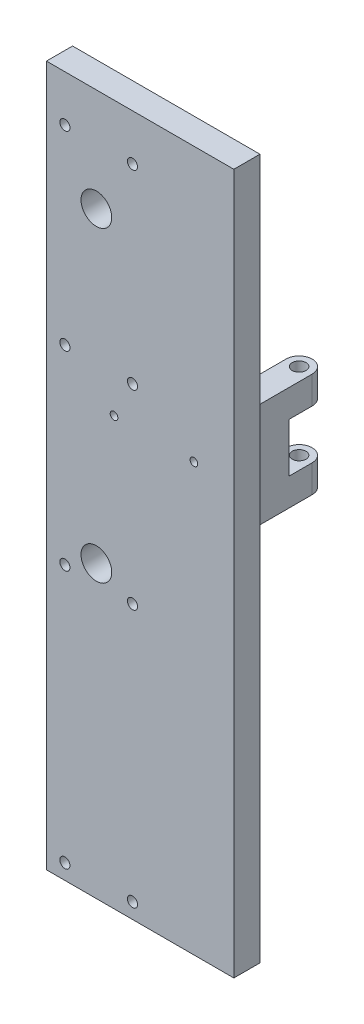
SolidWorks part; units mm, degrees
ref_plane "Face" through (0, 0, 0) normal (0, 0, 1) x (1, 0, 0)
ref_plane "Dessus" through (0, 0, 0) normal (0, 1, 0) x (1, 0, 0)
ref_plane "Droite" through (0, 0, 0) normal (1, 0, 0) x (0, 0, -1)
sketch "Esquisse1" plane through (0, 0, 0) normal (0, 0, 1) x (1, 0, 0)
  line L1 (0, 0) -> (122, 0)
  line L2 (0, 0) -> (0, 68)
  line L3 (0, 68) -> (122, 68)
  line L4 (122, 0) -> (122, 68)
  dimension "D1" = 122
  dimension "D2" = 68
extrude "Extrusion1" add sketch "Esquisse1" along normal blind 17
hole_wizard "Trou taraudé M61" positions "Esquisse5" profile "Esquisse4" tap size "M6" standard "ISO"
sketch "Esquisse5" plane through (0, 0, 17) normal (0, 0, 1) x (1, 0, 0)
  line L0 (122, 68) -> (0, 68) construction
  line L1 (0, 0) -> (122, 0) construction
  line L2 (122, 0) -> (122, 68) construction
  point P0 (44, 34)
  point P1 (96, 34)
  dimension "D1" = 34
  dimension "D2" = 34
  dimension "D3" = 52
  dimension "D4" = 26
sketch "Esquisse4" plane through (44, 34, 17) normal (1, 0, 0) x (0, -1, 0)
  line L0 (0, 0) -> (0, 17)
  line L1 (0, 17) -> (2.5, 17)
  line L2 (2.5, 17) -> (2.5, 0)
  line L5 (2.5, 0) -> (0, 0)
  line L11 (0, -6.35) -> (0, 107.95) construction
  dimension "Diamètre du trou pour taraudage jusqu'au prochain" = 5
  dimension "Profondeur du trou pour taraudage jusqu'au prochain" = 17
sketch "Esquisse6" plane through (0, 0, 0) normal (0, -1, 0) x (1, 0, 0)
  line L0 (119, 0) -> (119, -37)
  line L1 (102, 0) -> (102, -37)
  line L2 (0, 0) -> (122, 0) construction
  line L3 (102, 0) -> (119, 0)
  arc A0 (119, -37) -> (102, -37) centre (110.5, -37) cw
  circle A1 centre (110.5, -37) radius 4.5
  dimension "D4" = 9
  dimension "D1" = 17
  dimension "D2" = 3
  dimension "D3" = 37
extrude "Extrusion2" add sketch "Esquisse6" against normal blind 18
ref_plane "Plan1" through (0, 34, 0) normal (0, -1, 0) x (1, 0, 0)
mirror "Symétrie1" about plane through (0, 34, 0) normal (0, -1, 0) of "Extrusion2"
sketch "Esquisse7" plane through (119, 0, 0) normal (1, 0, 0) x (0, 0, -1)
  line L0 (37, 18) -> (0, 18) construction
  line L1 (0, 50) -> (22, 50)
  line L2 (0, 50) -> (0, 18)
  line L3 (0, 18) -> (22, 18)
  line L4 (22, 50) -> (22, 18)
  dimension "D1" = 22
extrude "Extrusion3" add sketch "Esquisse7" against normal up to surface (17 mm away)
sketch "Esquisse8" plane through (0, 0, 17) normal (0, 0, 1) x (1, 0, 0)
  line L0 (122, 0) -> (122, 68) construction
  line L1 (0, 68) -> (122, 68)
  line L2 (0, 68) -> (0, 212)
  line L3 (0, 212) -> (122, 212)
  line L4 (122, 68) -> (122, 212)
  line L5 (0, 0) -> (122, 0)
  line L6 (0, 0) -> (0, -244)
  line L7 (0, -244) -> (122, -244)
  line L8 (122, 0) -> (122, -244)
  dimension "D1" = 144
  dimension "D2" = 244
extrude "Extrusion4" add sketch "Esquisse8" against normal up to surface (17 mm away)
hole_wizard "Dégagement M61" positions "Esquisse3" profile "Esquisse2" hole size "M6" standard "ISO"
sketch "Esquisse3" plane through (0, 0, 17) normal (0, 0, 1) x (1, 0, 0)
  line L0 (0, 212) -> (0, -244) construction
  line L2 (122, 68) -> (0, 68) construction
  line L3 (0, 212) -> (0, -244) construction
  point P0 (12, 58)
  point P1 (56, 58)
  point P3 (56, -66)
  point P5 (12, -66)
  point P14 (12, -234)
  point P16 (56, -234)
  point P18 (12, 182)
  point P20 (56, 182)
  dimension "D1" = 12
  dimension "D2" = 12
  dimension "D3" = 44
  dimension "D4" = 44
  dimension "D5" = 44
  dimension "D6" = 44
  dimension "D7" = 10
  dimension "D8" = 10
  dimension "D9" = 124
  dimension "D10" = 124
  dimension "D11" = 124
  dimension "D12" = 124
  dimension "D13" = 168
  dimension "D14" = 168
  dimension "D15" = 12
  dimension "D16" = 12
sketch "Esquisse2" plane through (12, 58, 17) normal (1, 0, 0) x (0, -1, 0)
  line L0 (0, 0) -> (0, 62.5)
  line L1 (0, 62.5) -> (3.3, 62.5)
  line L2 (3.3, 62.5) -> (3.3, 0)
  line L5 (3.3, 0) -> (0, 0)
  line L11 (0, -6.35) -> (0, 107.95) construction
  dimension "Diamètre du perçage jusqu'au prochain" = 6.6
  dimension "Profondeur du perçage jusqu'au prochain" = 62.5
sketch "Esquisse9" plane through (0, 0, 17) normal (0, 0, 1) x (1, 0, 0)
  circle A0 centre (32.5, -55) radius 10
  circle A1 centre (32.5, 145) radius 10
  dimension "D1" = 20
  dimension "D2" = 20
extrude "Enlèv. mat.-Extru.1" cut sketch "Esquisse9" against normal through all
